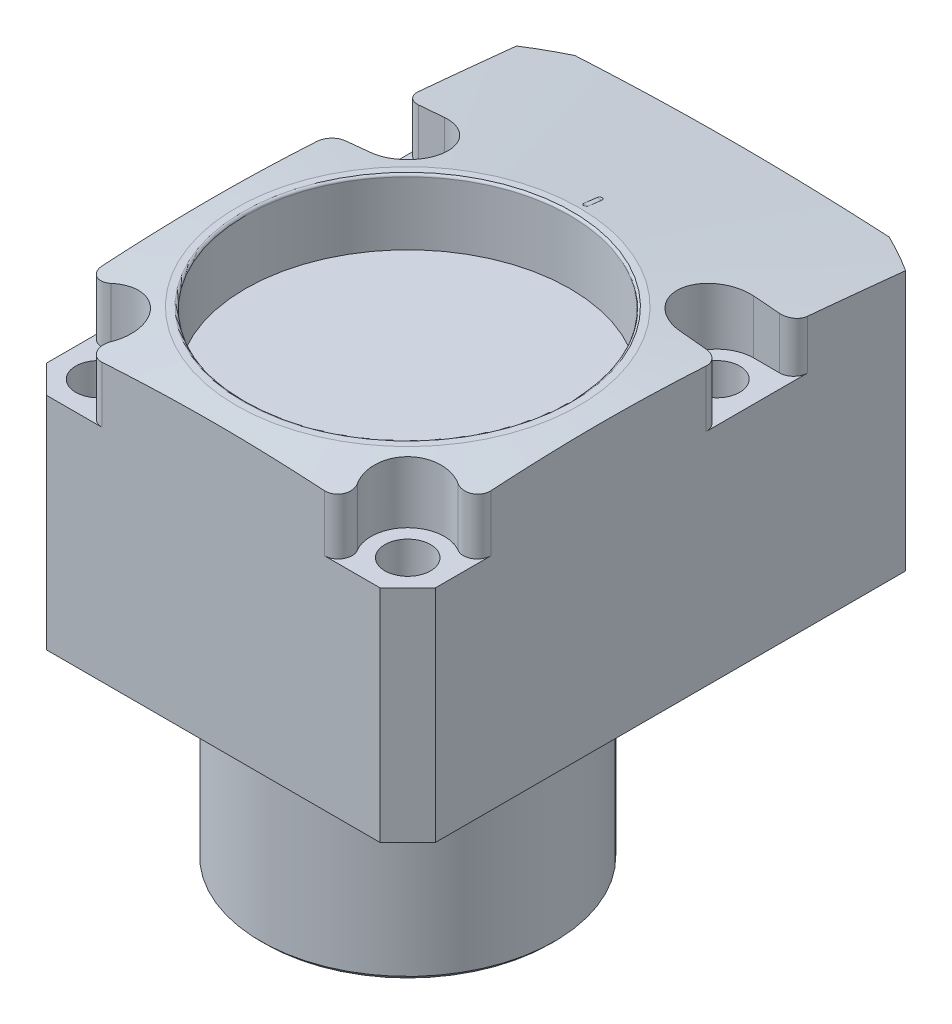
SolidWorks part; units mm, degrees
ref_plane "Front Plane" through (0, 0, 0) normal (0, 0, 1) x (1, 0, 0)
ref_plane "Top Plane" through (0, 0, 0) normal (0, 1, 0) x (1, 0, 0)
ref_plane "Right Plane" through (0, 0, 0) normal (1, 0, 0) x (0, 0, -1)
sketch "Sketch6" plane through (0, 0, 0) normal (0, 0, 1) x (1, 0, 0)
  line L0 (0, -8.9689) -> (0, 71.3762) construction
  line L1 (17.515, 30.5816) -> (18.5, 30.5816)
  line L2 (18.5, 30.5816) -> (38.895, 28.0774)
  line L3 (38.895, 28.0774) -> (38.895, 0)
  line L4 (38.895, 0) -> (15.885, 0)
  line L5 (15.885, 0) -> (15.885, -21.2979)
  line L6 (15.885, -21.2979) -> (0, -21.2979)
  line L7 (0, -21.2979) -> (0, 23.5116)
  line L8 (17.515, 30.5816) -> (17.515, 23.5116)
  line L9 (17.515, 23.5116) -> (0, 23.5116)
  dimension "D1" = 31.77
  dimension "D2" = 30.5816
  dimension "D3" = 21.2979
  dimension "D4" = 77.79
  dimension "D5" = 7
  dimension "D6" = 37
  dimension "D7" = 7.07
  dimension "D8" = 35.03
  dimension "D9" = 51.8795
revolve "Revolve3" add sketch "Sketch6" angle 360 about L0
fillet "Fillet7" radius 0.25 1 edges at (0, 30.5816, -17.515)
sketch "Sketch7" plane through (0, 0, 0) normal (0, -1, 0) x (1, 0, 0)
  line L0 (0, 0) -> (0, -52.3237) construction
  line L1 (-21, 21) -> (21, 21)
  line L2 (-21, 21) -> (-21, -35)
  line L3 (-21, -35) -> (21, -35)
  line L4 (21, 21) -> (21, -35)
  dimension "D1" = 42
  dimension "D2" = 56
  dimension "D3" = 21
extrude "Cut-Extrude5" cut sketch "Sketch7" against normal through all flip side to cut
sketch "Sketch8" plane through (0, 0, 0) normal (0, -1, 0) x (1, 0, 0)
  circle A0 centre (-16.6878, 16.6878) radius 2.4638
  dimension "D1" = 4.9276
  dimension "D2" = 16.6878
  dimension "D3" = 16.6878
extrude "Cut-Extrude6" cut sketch "Sketch8" against normal through all
pattern_circular "CirPattern2" count 4 over 360 about axis through (0, 0, 0) along (0, 1, 0) of "Cut-Extrude6"
chamfer "Chamfer1" distance 3 angle 45 2 edges at (-21, 14.6033, 21) (21, 14.6033, 21)
sketch "Sketch9" plane through (0, 30.5816, 0) normal (0, 1, 0) x (1, 0, 0)
  line L0 (-21, -18) -> (-18, -21) construction
  line L1 (-18, -21) -> (18, -21) construction
  line L2 (21, 20.6566) -> (21, 12.7191)
  line L3 (-21, -18) -> (-18, -21)
  line L4 (21, 12.7191) -> (16.6878, 12.7191)
  line L5 (16.6878, 20.6566) -> (21, 20.6566)
  line L6 (-16.6878, 20.6566) -> (-21, 20.6566)
  line L7 (-21, 32.7387) -> (-21, -18) construction
  line L8 (-21, 12.7191) -> (-16.6878, 12.7191)
  line L9 (-21, 20.6566) -> (-21, 12.7191)
  line L10 (-18, -21) -> (-15.3873, -21)
  line L11 (0, 0) -> (0, 26.6366) construction
  line L13 (-21, -15.3873) -> (-19.4941, -13.8815)
  line L14 (-13.8815, -19.4941) -> (-15.3873, -21)
  line L15 (-21, -15.3873) -> (-21, -18)
  line L16 (21, -15.3873) -> (21, -18)
  line L17 (13.8815, -19.4941) -> (15.3873, -21)
  line L18 (21, -15.3873) -> (19.4941, -13.8815)
  line L19 (18, -21) -> (15.3873, -21)
  line L20 (21, -18) -> (18, -21)
  arc A0 (-13.8815, -19.4941) -> (-19.4941, -13.8815) centre (-16.6878, -16.6878) ccw
  arc A1 (-16.6878, 12.7191) -> (-16.6878, 20.6566) centre (-16.6878, 16.6878) ccw
  arc A2 (13.8815, -19.4941) -> (19.4941, -13.8815) centre (16.6878, -16.6878) cw
  arc A3 (16.6878, 12.7191) -> (16.6878, 20.6566) centre (16.6878, 16.6878) cw
  dimension "D1" = 7.9375
extrude "Cut-Extrude7" cut sketch "Sketch9" against normal offset from surface (6.7818 mm away) 23.7998
fillet "Fillet4" radius 1.5 8 edges at (-21, 26.8192, -12.7191) (21, 26.518, -20.6566) (21, 26.8192, -12.7191) (21, 26.7282, 15.3873) (15.3873, 26.7282, 21) (-15.3873, 26.7282, 21) (-21, 26.7282, 15.3873) (-21, 26.518, -20.6566)
fillet "Fillet5" radius 0.4 1 edges at (0, 0, -15.885)
chamfer "Chamfer2" distance 0.5 angle 45 1 edges at (0, -21.2979, -15.885)
ref_plane "Plane1" through (0, 17.018, 0) normal (0, -1, 0) x (1, 0, 0)
sketch "Sketch11" plane through (0, 17.018, 0) normal (0, -1, 0) x (1, 0, 0)
  line L0 (-10, -4.7006) -> (-10, -58.3255) construction
  line L1 (-16.9653, -35) -> (16.9653, -35) construction
  line L2 (-16.1849, -34.75) -> (-15.6396, -32.1846)
  line L3 (-15.6396, -32.1846) -> (-14.9784, -31.5234)
  line L10 (-10, -35) -> (-20.4775, -35)
  line L11 (-10, -20.018) -> (-10, -35)
  line L12 (-14.9784, -20.018) -> (-10, -20.018)
  line L13 (-14.9784, -31.5234) -> (-14.9784, -20.018)
  line L15 (-20.4775, -34.75) -> (-16.1849, -34.75)
  line L16 (-20.4775, -35) -> (-20.4775, -34.75)
  dimension "D1" = 10
  dimension "D2" = 0.25
  dimension "D3" = 14.732
  dimension "D4" = 9.9568
  dimension "D5" = 20.955
  dimension "D6" = 12
  dimension "D7" = 12.3698
  dimension "D8" = 45
  dimension "D9" = 2.5654
revolve "Cut-Revolve5" cut sketch "Sketch11" angle 360 about L0
ref_plane "Plane2" through (0, 0, -26.7462) normal (0, 0, 1) x (1, 0, 0)
sketch "Sketch13" plane through (0, 0, -26.7462) normal (0, 0, 1) x (1, 0, 0)
  line L0 (-13.4544, 17.7546) -> (-13.4544, 5.5009)
  line L1 (-13.4544, 5.5009) -> (-14.1293, 4.826)
  line L2 (-14.572, 2.7432) -> (-15.6261, 2.7432)
  line L3 (-15.6261, 2.7432) -> (-15.6261, 0)
  line L4 (-16.285, 0) -> (16.285, 0) construction
  line L5 (-15.6261, 0) -> (-10, 0)
  line L6 (-10, 0) -> (-10, 17.7546)
  line L7 (-10, 17.7546) -> (-13.4544, 17.7546)
  line L8 (-10, 15.2099) -> (-10, -4.3918) construction
  line L9 (-14.572, 2.7432) -> (-14.1293, 4.826)
  line L10 (-14.572, 2.7432) -> (-10, 2.7432) construction
  dimension "D1" = 10
  dimension "D2" = 6.9088
  dimension "D3" = 15.0114
  dimension "D4" = 2.7432
  dimension "D5" = 11.2522
  dimension "D6" = 45
  dimension "D7" = 9.144
  dimension "D8" = 2.0828
  dimension "D9" = 12
revolve "Cut-Revolve6" cut sketch "Sketch13" angle 360 about L8
sketch "Sketch1" plane through (20.475, 11.3284, -26.7462) normal (0, 0, 1) x (1, 0, 0)
  line L0 (-30.475, 0) -> (-30.475, 50000) construction
  line L1 (-28.8875, -3.175) -> (-26.6015, -3.175)
  line L2 (-26.6015, -3.175) -> (-26.6015, -6.0714)
  line L3 (-26.5634, -8.5852) -> (50000, -8.5852) construction
  line L4 (-27.4778, -6.985) -> (-27.4778, -7.6708)
  line L5 (-26.5634, -8.5852) -> (-25.014, -8.5852)
  line L6 (-25.014, -8.5852) -> (-25.014, -10.0076)
  line L7 (-25.014, -10.0076) -> (-25.692, -10.0076)
  line L8 (-27.808, -10.0076) -> (-27.808, -11.1252)
  line L9 (-27.808, -11.1252) -> (-28.8875, -11.1252)
  line L10 (-28.8875, -11.1252) -> (-28.8875, -3.175)
  line L11 (-1000, -8.5852) -> (-28.8875, -8.5852) construction
  line L12 (-26.114, -10.0076) -> (-27.808, -10.0076)
  arc A0 (-26.6015, -6.0714) -> (-27.4778, -6.985) centre (-26.5634, -6.985) ccw
  arc A1 (-27.4778, -7.6708) -> (-26.5634, -8.5852) centre (-26.5634, -7.6708) ccw
  arc A2 (-26.114, -10.0076) -> (-25.692, -10.0076) centre (-25.903, -10.8712) ccw
  dimension "D8" = 1.6002
  dimension "D9" = 0.9144
  dimension "D10" = 7.9502
  dimension "D11" = 1.778
  dimension "D1" = 7.747
  dimension "D2" = 5.9944
  dimension "D3" = 10.922
  dimension "D4" = 5.334
  dimension "D5" = 3.175
  dimension "D6" = 1.4224
  dimension "D7" = 2.54
  dimension "D12" = 0.8636
revolve "Revolve1" add sketch "Sketch1" angle 360 about L0
sketch "Sketch2" plane through (-27.5235, 0.2032, -26.7462) normal (0, -1, 0) x (0, 0, 1)
  line L0 (0, 0) -> (0, 50000) construction
  line L1 (0, -15.6904) -> (1.5875, -16.607)
  line L2 (1.5875, -16.607) -> (1.5875, -18.44)
  line L3 (1.5875, -18.44) -> (0, -19.3566)
  line L4 (0, -19.3566) -> (-1.5875, -18.44)
  line L5 (-1.5875, -18.44) -> (-1.5875, -16.607)
  line L6 (-1.5875, -16.607) -> (0, -15.6904)
  circle A0 centre (0, -17.5235) radius 1.5875 construction
  dimension "D1" = 3.175
extrude "Cut-Extrude1" cut sketch "Sketch2" against normal up to surface (7.9502 mm away)
other "PORT_ADTAPTER<1>"
mirror "Mirror4" about plane through (0, 0, 0) normal (1, 0, 0) of "Revolve1", "Cut-Extrude1", "Cut-Revolve6", "Cut-Revolve5"
sketch "Sketch17" plane through (0, 0, 0) normal (1, 0, 0) x (0, 0, -1)
  line L0 (18.5428, 31.3421) -> (21.6201, 30.9642)
  line L7 (35, 28.5557) -> (18.5, 30.5816) construction
  line L16 (14.3637, 31.8552) -> (30.0966, 29.9234) construction
  line L18 (19.3368, 31.2446) -> (20.826, 31.0617) construction
  line L20 (19.2393, 30.4505) -> (20.7286, 30.2677)
  line L21 (35, 28.5557) -> (18.5, 30.5816) construction
  line L22 (18.9963, 30.5207) -> (20.9814, 30.2769) construction
  arc A0 (18.5428, 31.3421) -> (19.2393, 30.4505) centre (19.3368, 31.2446) ccw
  arc A1 (20.7286, 30.2677) -> (21.6201, 30.9642) centre (20.826, 31.0617) ccw
  point P4 (20.0814, 30.1415)
  dimension "D1" = 0.8
  dimension "D5" = 1.6
  dimension "D2" = 0.76
  dimension "D3" = 2
  dimension "D4" = 0.5
ref_plane "Plane3" through (0.0052, 28.5557, -35) normal (0, 0.9925, -0.1219) x (-1, 0, 0)
revolve "ZERO_MARK_INDICATOR" cut sketch "Sketch17" angle 360 about L16
